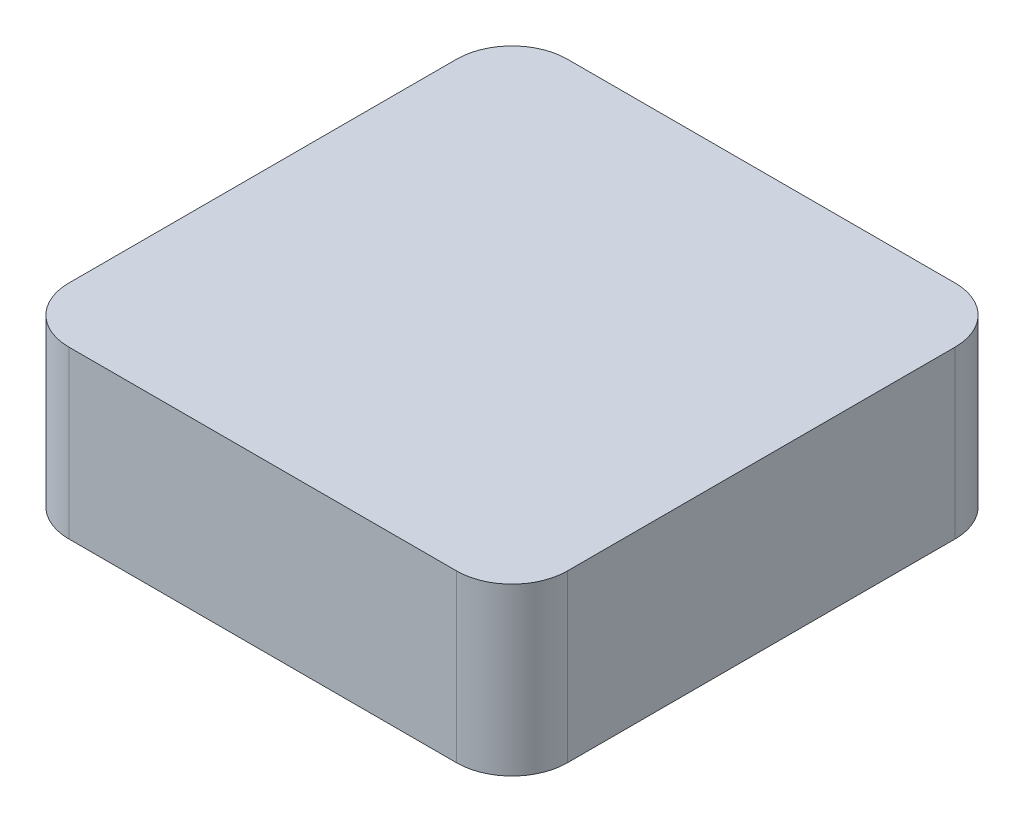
SolidWorks part; units mm, degrees
ref_plane "Front Plane" through (0, 0, 0) normal (0, 0, 1) x (1, 0, 0)
ref_plane "Top Plane" through (0, 0, 0) normal (0, 1, 0) x (1, 0, 0)
ref_plane "Right Plane" through (0, 0, 0) normal (1, 0, 0) x (0, 0, -1)
sketch "Sketch1" plane through (0, 0, 0) normal (0, 1, 0) x (1, 0, 0)
  circle A0 centre (0, 0) radius 25
  dimension "D1" = 50
sketch "Sketch2" plane through (0, 0, 0) normal (0, 1, 0) x (1, 0, 0)
  line L0 (-6, 24.2693) -> (0, 35)
  line L1 (0, 35) -> (6, 24.2693)
  line L2 (0, 0) -> (17.6777, 17.6777) construction
  line L3 (0, 0) -> (25, 0) construction
  line L4 (13.785, 20.856) -> (21.2132, 21.2132)
  line L5 (21.2132, 21.2132) -> (20.856, 13.785)
  line L6 (17.6777, 17.6777) -> (21.2132, 21.2132) construction
  line L7 (-6, 24.2693) -> (-7.9085, 20.856)
  line L8 (-7.9085, 20.856) -> (7.9085, 20.856)
  line L9 (7.9085, 20.856) -> (6, 24.2693)
  line L10 (13.785, 20.856) -> (9.0692, 20.6293)
  line L11 (9.0692, 20.6293) -> (20.6293, 9.0692)
  line L12 (20.6293, 9.0692) -> (20.856, 13.785)
  circle A0 centre (0, 0) radius 25 construction
  circle A1 centre (0, 0) radius 25 construction
  dimension "D1" = 35
  dimension "D2" = 12
  dimension "D3" = 45
  dimension "D4" = 10
  dimension "D5" = 30
  dimension "D6" = 4
extrude "Boss-Extrude1" add sketch "Sketch1" along normal blind 13 draft 2
fillet "Fillet1" radius 4 1 edges at (0, 13, 24.546)
extrude "Boss-Extrude3" add sketch "Sketch2" along normal blind 6.5 draft 3 contours L11 L12 L5 L4 L10 | L1 L9 L8 L7 L0
fillet "Fillet2" radius 0.5 12 edges at (17.5172, 6.5, -17.5172) (20.6881, 3.2457, -13.8329) (17.3674, 6.5, -20.6872) (21.0341, 3.25, -21.0341) (13.8329, 3.2457, -20.6881) (20.6872, 6.5, -17.3674) (0, 6.5, -24.773) (-5.8496, 3.2497, -24.1893) (-2.8498, 6.5, -29.2052) (0, 3.25, -34.651) (2.8498, 6.5, -29.2052) (5.8496, 3.2497, -24.1893)
pattern_circular "CirPattern4" count 4 over 360 about axis through (0, 13, 0) along (0, 1, 0) of "Boss-Extrude3", "Fillet2"
sketch "Sketch3" plane through (0, 0, 0) normal (0, 1, 0) x (1, 0, 0)
  line L1 (-45, -45) -> (45, -45)
  line L2 (-45, -45) -> (-45, 45)
  line L3 (-45, 45) -> (45, 45)
  line L4 (45, -45) -> (45, 45)
  line L5 (-45, -45) -> (45, 45) construction
  line L6 (-45, 45) -> (45, -45) construction
  point P0 (0, 0)
  dimension "D1" = 90
extrude "Boss-Extrude4" add sketch "Sketch3" along normal blind 30 separate body
fillet "Fillet3" radius 10 4 edges at (45, 15, 45) (-45, 15, 45) (45, 15, -45) (-45, 15, -45)
combine bodies "Combine1" bodies to combine 107 106
